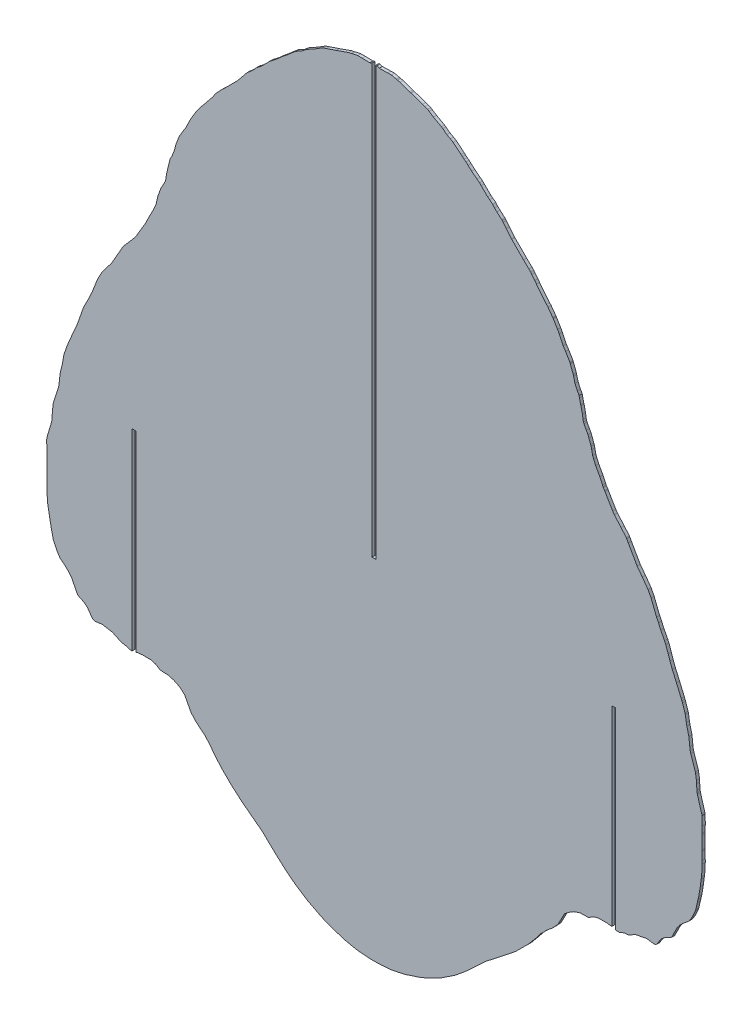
SolidWorks part; units mm, degrees
ref_plane "Спереди" through (0, 0, 0) normal (0, 0, 1) x (1, 0, 0)
ref_plane "Сверху" through (0, 0, 0) normal (0, 1, 0) x (1, 0, 0)
ref_plane "Справа" through (0, 0, 0) normal (1, 0, 0) x (0, 0, -1)
sketch "Model" plane through (0, 0, 0) normal (0, 0, 1) x (1, 0, 0)
  line L0 (-7497.9467, 2023.4558) -> (-7500.6426, 2017.1112)
  line L1 (-7500.6426, 2017.1112) -> (-7501.0305, 2016.1207)
  line L2 (-7501.0305, 2016.1207) -> (-7501.4279, 2015.1691)
  line L3 (-7501.4279, 2015.1691) -> (-7503.0784, 2010.3746)
  line L4 (-7503.0784, 2010.3746) -> (-7503.3023, 2009.66)
  line L5 (-7503.3023, 2009.66) -> (-7504.1535, 2004.848)
  line L6 (-7504.1535, 2004.848) -> (-7504.496, 2003.0145)
  line L7 (-7504.496, 2003.0145) -> (-7505.7197, 1998.1165)
  line L8 (-7505.7197, 1998.1165) -> (-7506.4076, 1992.1158)
  line L9 (-7506.4076, 1992.1158) -> (-7506.7012, 1990.1251)
  line L10 (-7506.7012, 1990.1251) -> (-7506.946, 1989.2308)
  line L11 (-7506.946, 1989.2308) -> (-7510.1433, 1979.3137)
  line L12 (-7510.1433, 1979.3137) -> (-7510.716, 1974.5936)
  line L13 (-7510.716, 1974.5936) -> (-7510.7209, 1974.5536)
  line L14 (-7510.7209, 1974.5536) -> (-7510.7259, 1974.5137)
  line L15 (-7510.7259, 1974.5137) -> (-7510.7487, 1974.0958)
  line L16 (-7510.7487, 1974.0958) -> (-7510.7715, 1973.6781)
  line L17 (-7510.7715, 1973.6781) -> (-7511.1722, 1968.5629)
  line L18 (-7511.1722, 1968.5629) -> (-7511.4632, 1967.2933)
  line L19 (-7511.4632, 1967.2933) -> (-7514.367, 1957.5712)
  line L20 (-7514.367, 1957.5712) -> (-7514.4008, 1956.9962)
  line L21 (-7514.4008, 1956.9962) -> (-7514.4101, 1956.5912)
  line L22 (-7514.4101, 1956.5912) -> (-7514.4193, 1956.1862)
  line L23 (-7514.4193, 1956.1862) -> (-7514.4247, 1955.3981)
  line L24 (-7514.4247, 1955.3981) -> (-7514.2628, 1947.1219)
  line L25 (-7514.2628, 1947.1219) -> (-7514.2212, 1937.3397)
  line L26 (-7514.2212, 1937.3397) -> (-7514.2091, 1936.9847)
  line L27 (-7514.2091, 1936.9847) -> (-7514.3719, 1932.8768)
  line L28 (-7514.3719, 1932.8768) -> (-7514.3864, 1930.5543)
  line L29 (-7514.3864, 1930.5543) -> (-7514.1103, 1925.2838)
  line L30 (-7514.1103, 1925.2838) -> (-7513.8456, 1921.2826)
  line L31 (-7513.8456, 1921.2826) -> (-7513.1127, 1917.1886)
  line L32 (-7513.1127, 1917.1886) -> (-7511.3726, 1907.7911)
  line L33 (-7511.3726, 1907.7911) -> (-7510.8214, 1905.5643)
  line L34 (-7510.8214, 1905.5643) -> (-7510.2805, 1902.9569)
  line L35 (-7510.2805, 1902.9569) -> (-7507.7917, 1897.6613)
  line L36 (-7507.7917, 1897.6613) -> (-7505.8454, 1894.5458)
  line L37 (-7505.8454, 1894.5458) -> (-7503.2841, 1892.5111)
  line L38 (-7503.2841, 1892.5111) -> (-7501.9998, 1891.3712)
  line L39 (-7501.9998, 1891.3712) -> (-7499.9927, 1889.4144)
  line L40 (-7499.9927, 1889.4144) -> (-7498.9104, 1887.8602)
  line L41 (-7498.9104, 1887.8602) -> (-7498.3658, 1887.2845)
  line L42 (-7498.3658, 1887.2845) -> (-7494.419, 1879.6002)
  line L43 (-7494.419, 1879.6002) -> (-7494.3736, 1879.5624)
  line L44 (-7494.3736, 1879.5624) -> (-7494.3282, 1879.5245)
  line L45 (-7494.3282, 1879.5245) -> (-7490.8269, 1877.798)
  line L46 (-7490.8269, 1877.798) -> (-7490.2704, 1877.4926)
  line L47 (-7490.2704, 1877.4926) -> (-7488.3005, 1875.9325)
  line L48 (-7488.3005, 1875.9325) -> (-7485.4491, 1871.9811)
  line L49 (-7485.4491, 1871.9811) -> (-7484.6983, 1870.9366)
  line L50 (-7484.6983, 1870.9366) -> (-7484.0835, 1870.7382)
  line L51 (-7484.0835, 1870.7382) -> (-7483.4687, 1870.5397)
  line L52 (-7483.4687, 1870.5397) -> (-7483.3924, 1870.4733)
  line L53 (-7483.3924, 1870.4733) -> (-7483.316, 1870.4069)
  line L54 (-7483.316, 1870.4069) -> (-7482.274, 1870.5902)
  line L55 (-7482.274, 1870.5902) -> (-7478.4124, 1871.0638)
  line L56 (-7478.4124, 1871.0638) -> (-7477.9965, 1870.9762)
  line L57 (-7477.9965, 1870.9762) -> (-7477.5807, 1870.8885)
  line L58 (-7477.5807, 1870.8885) -> (-7472.6305, 1870.0441)
  line L59 (-7472.6305, 1870.0441) -> (-7472.0241, 1869.8947)
  line L60 (-7472.0241, 1869.8947) -> (-7471.4176, 1869.745)
  line L61 (-7471.4176, 1869.745) -> (-7471.1804, 1869.6014)
  line L62 (-7471.1804, 1869.6014) -> (-7470.9433, 1869.4576)
  line L63 (-7470.9433, 1869.4576) -> (-7470.283, 1869.1666)
  line L64 (-7470.283, 1869.1666) -> (-7469.6228, 1868.8756)
  line L65 (-7469.6228, 1868.8756) -> (-7466.2521, 1867.1725)
  line L66 (-7466.2521, 1867.1725) -> (-7464.3822, 1866.9462)
  line L67 (-7464.3822, 1866.9462) -> (-7463.2148, 1866.6659)
  line L68 (-7463.2148, 1866.6659) -> (-7462.0473, 1866.3856)
  line L69 (-7462.0473, 1866.3856) -> (-7461.513, 1866.0946)
  line L70 (-7461.513, 1866.0946) -> (-7460.9787, 1865.8033)
  line L71 (-7460.9787, 1865.8033) -> (-7460.7605, 1865.7833)
  line L72 (-7460.7605, 1865.7833) -> (-7460.5423, 1865.7633)
  line L73 (-7460.5423, 1865.7633) -> (-7459.7682, 1865.7955)
  line L74 (-7459.7682, 1865.7955) -> (-7459.2442, 1865.8174)
  line L75 (-7459.2442, 1865.8174) -> (-7459.2442, 1990.1417)
  line L76 (-7459.2442, 1990.1417) -> (-7458.9942, 1990.1417)
  line L77 (-7458.9942, 1990.1417) -> (-7456.9942, 1990.1417)
  line L78 (-7456.9942, 1990.1417) -> (-7456.7442, 1990.1417)
  line L79 (-7456.7442, 1990.1417) -> (-7456.7442, 1866.3402)
  line L80 (-7456.7442, 1866.3402) -> (-7456.4584, 1866.4423)
  line L81 (-7456.4584, 1866.4423) -> (-7455.9226, 1866.6337)
  line L82 (-7455.9226, 1866.6337) -> (-7452.735, 1866.9823)
  line L83 (-7452.735, 1866.9823) -> (-7447.3945, 1866.9166)
  line L84 (-7447.3945, 1866.9166) -> (-7446.8888, 1866.9794)
  line L85 (-7446.8888, 1866.9794) -> (-7444.6596, 1866.2577)
  line L86 (-7444.6596, 1866.2577) -> (-7444.0137, 1866.0345)
  line L87 (-7444.0137, 1866.0345) -> (-7441.2335, 1864.2804)
  line L88 (-7441.2335, 1864.2804) -> (-7441.1634, 1864.2372)
  line L89 (-7441.1634, 1864.2372) -> (-7441.0933, 1864.194)
  line L90 (-7441.0933, 1864.194) -> (-7441.0633, 1864.191)
  line L91 (-7441.0633, 1864.191) -> (-7441.0334, 1864.1881)
  line L92 (-7441.0334, 1864.1881) -> (-7440.9624, 1864.1739)
  line L93 (-7440.9624, 1864.1739) -> (-7440.8914, 1864.1595)
  line L94 (-7440.8914, 1864.1595) -> (-7440.7779, 1864.1625)
  line L95 (-7440.7779, 1864.1625) -> (-7440.6644, 1864.1652)
  line L96 (-7440.6644, 1864.1652) -> (-7435.7736, 1863.9169)
  line L97 (-7435.7736, 1863.9169) -> (-7435.3781, 1863.9164)
  line L98 (-7435.3781, 1863.9164) -> (-7434.6278, 1863.6351)
  line L99 (-7434.6278, 1863.6351) -> (-7433.8775, 1863.3536)
  line L100 (-7433.8775, 1863.3536) -> (-7433.4218, 1863.2167)
  line L101 (-7433.4218, 1863.2167) -> (-7432.6613, 1863.059)
  line L102 (-7432.6613, 1863.059) -> (-7431.854, 1862.7081)
  line L103 (-7431.854, 1862.7081) -> (-7428.3172, 1860.9379)
  line L104 (-7428.3172, 1860.9379) -> (-7425.2409, 1858.1959)
  line L105 (-7425.2409, 1858.1959) -> (-7425.2293, 1858.1852)
  line L106 (-7425.2293, 1858.1852) -> (-7425.2177, 1858.1747)
  line L107 (-7425.2177, 1858.1747) -> (-7424.9908, 1857.7369)
  line L108 (-7424.9908, 1857.7369) -> (-7421.3787, 1850.8043)
  line L109 (-7421.3787, 1850.8043) -> (-7421.003, 1850.2777)
  line L110 (-7421.003, 1850.2777) -> (-7418.5829, 1847.433)
  line L111 (-7418.5829, 1847.433) -> (-7416.2365, 1845.399)
  line L112 (-7416.2365, 1845.399) -> (-7412.2569, 1842.1661)
  line L113 (-7412.2569, 1842.1661) -> (-7410.5129, 1840.1593)
  line L114 (-7410.5129, 1840.1593) -> (-7409.7671, 1839.4247)
  line L115 (-7409.7671, 1839.4247) -> (-7406.8879, 1835.6644)
  line L116 (-7406.8879, 1835.6644) -> (-7402.7645, 1830.6551)
  line L117 (-7402.7645, 1830.6551) -> (-7402.3004, 1830.1178)
  line L118 (-7402.3004, 1830.1178) -> (-7401.8362, 1829.5804)
  line L119 (-7401.8362, 1829.5804) -> (-7397.1856, 1824.89)
  line L120 (-7397.1856, 1824.89) -> (-7394.3311, 1822.0721)
  line L121 (-7394.3311, 1822.0721) -> (-7391.2584, 1819.538)
  line L122 (-7391.2584, 1819.538) -> (-7390.4303, 1818.7936)
  line L123 (-7390.4303, 1818.7936) -> (-7389.1507, 1817.6268)
  line L124 (-7389.1507, 1817.6268) -> (-7386.6953, 1815.7213)
  line L125 (-7386.6953, 1815.7213) -> (-7374.9699, 1806.7738)
  line L126 (-7374.9699, 1806.7738) -> (-7370.1001, 1802.0641)
  line L127 (-7370.1001, 1802.0641) -> (-7365.4616, 1797.7201)
  line L128 (-7365.4616, 1797.7201) -> (-7360.5326, 1793.3229)
  line L129 (-7360.5326, 1793.3229) -> (-7355.0083, 1788.9054)
  line L130 (-7355.0083, 1788.9054) -> (-7353.362, 1787.6927)
  line L131 (-7353.362, 1787.6927) -> (-7350.607, 1785.8756)
  line L132 (-7350.607, 1785.8756) -> (-7345.9025, 1782.8116)
  line L133 (-7345.9025, 1782.8116) -> (-7342.8212, 1781.2672)
  line L134 (-7342.8212, 1781.2672) -> (-7338.9552, 1779.2279)
  line L135 (-7338.9552, 1779.2279) -> (-7335.6744, 1777.6757)
  line L136 (-7335.6744, 1777.6757) -> (-7332.1744, 1776.2101)
  line L137 (-7332.1744, 1776.2101) -> (-7328.8162, 1774.9982)
  line L138 (-7328.8162, 1774.9982) -> (-7324.9663, 1773.8363)
  line L139 (-7324.9663, 1773.8363) -> (-7322.8491, 1773.1232)
  line L140 (-7322.8491, 1773.1232) -> (-7322.1192, 1772.9066)
  line L141 (-7322.1192, 1772.9066) -> (-7317.4443, 1771.8556)
  line L142 (-7317.4443, 1771.8556) -> (-7317.3058, 1771.8246)
  line L143 (-7317.3058, 1771.8246) -> (-7316.9245, 1771.7833)
  line L144 (-7316.9245, 1771.7833) -> (-7313.7443, 1771.1263)
  line L145 (-7313.7443, 1771.1263) -> (-7307.0124, 1770.5392)
  line L146 (-7307.0124, 1770.5392) -> (-7302.6145, 1770.422)
  line L147 (-7302.6145, 1770.422) -> (-7297.9105, 1770.5692)
  line L148 (-7297.9105, 1770.5692) -> (-7291.3652, 1771.1542)
  line L149 (-7291.3652, 1771.1542) -> (-7288.5675, 1771.7479)
  line L150 (-7288.5675, 1771.7479) -> (-7288.2836, 1771.7816)
  line L151 (-7288.2836, 1771.7816) -> (-7287.9997, 1771.8151)
  line L152 (-7287.9997, 1771.8151) -> (-7287.7908, 1771.8619)
  line L153 (-7287.7908, 1771.8619) -> (-7287.5819, 1771.9088)
  line L154 (-7287.5819, 1771.9088) -> (-7282.5796, 1773.0704)
  line L155 (-7282.5796, 1773.0704) -> (-7281.8471, 1773.2906)
  line L156 (-7281.8471, 1773.2906) -> (-7279.5327, 1774.0966)
  line L157 (-7279.5327, 1774.0966) -> (-7275.6944, 1775.3065)
  line L158 (-7275.6944, 1775.3065) -> (-7272.4718, 1776.4506)
  line L159 (-7272.4718, 1776.4506) -> (-7269.6285, 1777.663)
  line L160 (-7269.6285, 1777.663) -> (-7266.5203, 1779.1383)
  line L161 (-7266.5203, 1779.1383) -> (-7262.4004, 1781.285)
  line L162 (-7262.4004, 1781.285) -> (-7259.2552, 1782.8859)
  line L163 (-7259.2552, 1782.8859) -> (-7254.3601, 1786.1176)
  line L164 (-7254.3601, 1786.1176) -> (-7251.7627, 1787.8268)
  line L165 (-7251.7627, 1787.8268) -> (-7250.3816, 1788.8214)
  line L166 (-7250.3816, 1788.8214) -> (-7244.6867, 1793.4034)
  line L167 (-7244.6867, 1793.4034) -> (-7240.6341, 1797.0858)
  line L168 (-7240.6341, 1797.0858) -> (-7236.6093, 1800.7867)
  line L169 (-7236.6093, 1800.7867) -> (-7230.3919, 1806.5961)
  line L170 (-7230.3919, 1806.5961) -> (-7229.1579, 1807.5507)
  line L171 (-7229.1579, 1807.5507) -> (-7212.9107, 1820.2904)
  line L172 (-7212.9107, 1820.2904) -> (-7211.1697, 1821.8143)
  line L173 (-7211.1697, 1821.8143) -> (-7204.0301, 1828.8754)
  line L174 (-7204.0301, 1828.8754) -> (-7203.6757, 1829.2299)
  line L175 (-7203.6757, 1829.2299) -> (-7202.7729, 1830.2147)
  line L176 (-7202.7729, 1830.2147) -> (-7198.2298, 1835.6429)
  line L177 (-7198.2298, 1835.6429) -> (-7195.1637, 1839.6456)
  line L178 (-7195.1637, 1839.6456) -> (-7192.9741, 1841.7357)
  line L179 (-7192.9741, 1841.7357) -> (-7191.7177, 1843.1935)
  line L180 (-7191.7177, 1843.1935) -> (-7188.1277, 1846.1334)
  line L181 (-7188.1277, 1846.1334) -> (-7187.2744, 1846.8663)
  line L182 (-7187.2744, 1846.8663) -> (-7184.2405, 1850.1603)
  line L183 (-7184.2405, 1850.1603) -> (-7183.9644, 1850.577)
  line L184 (-7183.9644, 1850.577) -> (-7179.7517, 1858.5421)
  line L185 (-7179.7517, 1858.5421) -> (-7179.7426, 1858.5563)
  line L186 (-7179.7426, 1858.5563) -> (-7179.7238, 1858.5734)
  line L187 (-7179.7238, 1858.5734) -> (-7179.705, 1858.5905)
  line L188 (-7179.705, 1858.5905) -> (-7175.8548, 1861.4667)
  line L189 (-7175.8548, 1861.4667) -> (-7174.1703, 1862.4039)
  line L190 (-7174.1703, 1862.4039) -> (-7172.105, 1863.2098)
  line L191 (-7172.105, 1863.2098) -> (-7169.6242, 1864.0177)
  line L192 (-7169.6242, 1864.0177) -> (-7168.7214, 1863.9991)
  line L193 (-7168.7214, 1863.9991) -> (-7164.3725, 1864.1088)
  line L194 (-7164.3725, 1864.1088) -> (-7164.2621, 1864.1268)
  line L195 (-7164.2621, 1864.1268) -> (-7164.1516, 1864.1447)
  line L196 (-7164.1516, 1864.1447) -> (-7161.5025, 1865.9171)
  line L197 (-7161.5025, 1865.9171) -> (-7160.7705, 1866.2316)
  line L198 (-7160.7705, 1866.2316) -> (-7157.9358, 1867.0131)
  line L199 (-7157.9358, 1867.0131) -> (-7157.6336, 1866.9811)
  line L200 (-7157.6336, 1866.9811) -> (-7152.4018, 1866.9789)
  line L201 (-7152.4018, 1866.9789) -> (-7149.2442, 1866.6466)
  line L202 (-7149.2442, 1866.6466) -> (-7149.2442, 1990.1417)
  line L203 (-7149.2442, 1990.1417) -> (-7148.9942, 1990.1417)
  line L204 (-7148.9942, 1990.1417) -> (-7146.9942, 1990.1417)
  line L205 (-7146.9942, 1990.1417) -> (-7146.7442, 1990.1417)
  line L206 (-7146.7442, 1990.1417) -> (-7146.7442, 1865.8138)
  line L207 (-7146.7442, 1865.8138) -> (-7146.7356, 1865.8109)
  line L208 (-7146.7356, 1865.8109) -> (-7144.831, 1865.7367)
  line L209 (-7144.831, 1865.7367) -> (-7144.4452, 1865.7391)
  line L210 (-7144.4452, 1865.7391) -> (-7143.717, 1866.1136)
  line L211 (-7143.717, 1866.1136) -> (-7142.9889, 1866.4879)
  line L212 (-7142.9889, 1866.4879) -> (-7141.9963, 1866.744)
  line L213 (-7141.9963, 1866.744) -> (-7141.0037, 1867.0001)
  line L214 (-7141.0037, 1867.0001) -> (-7138.4158, 1867.2423)
  line L215 (-7138.4158, 1867.2423) -> (-7134.6339, 1869.3578)
  line L216 (-7134.6339, 1869.3578) -> (-7134.2803, 1869.5289)
  line L217 (-7134.2803, 1869.5289) -> (-7134.0622, 1869.663)
  line L218 (-7134.0622, 1869.663) -> (-7133.6119, 1869.7863)
  line L219 (-7133.6119, 1869.7863) -> (-7128.0332, 1870.8636)
  line L220 (-7128.0332, 1870.8636) -> (-7126.8495, 1871.1188)
  line L221 (-7126.8495, 1871.1188) -> (-7125.7958, 1870.9896)
  line L222 (-7125.7958, 1870.9896) -> (-7124.7422, 1870.8602)
  line L223 (-7124.7422, 1870.8602) -> (-7123.4416, 1870.6737)
  line L224 (-7123.4416, 1870.6737) -> (-7122.8226, 1870.545)
  line L225 (-7122.8226, 1870.545) -> (-7122.2036, 1870.4161)
  line L226 (-7122.2036, 1870.4161) -> (-7121.9822, 1870.6022)
  line L227 (-7121.9822, 1870.6022) -> (-7121.3062, 1870.6793)
  line L228 (-7121.3062, 1870.6793) -> (-7120.6302, 1870.7565)
  line L229 (-7120.6302, 1870.7565) -> (-7119.7912, 1871.9027)
  line L230 (-7119.7912, 1871.9027) -> (-7117.2733, 1875.6085)
  line L231 (-7117.2733, 1875.6085) -> (-7117.2016, 1875.6847)
  line L232 (-7117.2016, 1875.6847) -> (-7117.1299, 1875.7609)
  line L233 (-7117.1299, 1875.7609) -> (-7117.0839, 1875.8419)
  line L234 (-7117.0839, 1875.8419) -> (-7117.0379, 1875.923)
  line L235 (-7117.0379, 1875.923) -> (-7116.7871, 1876.1263)
  line L236 (-7116.7871, 1876.1263) -> (-7114.8937, 1877.566)
  line L237 (-7114.8937, 1877.566) -> (-7114.3626, 1877.8517)
  line L238 (-7114.3626, 1877.8517) -> (-7113.8316, 1878.1373)
  line L239 (-7113.8316, 1878.1373) -> (-7110.8553, 1879.6276)
  line L240 (-7110.8553, 1879.6276) -> (-7110.6672, 1879.7914)
  line L241 (-7110.6672, 1879.7914) -> (-7106.8875, 1887.2306)
  line L242 (-7106.8875, 1887.2306) -> (-7106.6991, 1887.4247)
  line L243 (-7106.6991, 1887.4247) -> (-7106.5106, 1887.6188)
  line L244 (-7106.5106, 1887.6188) -> (-7105.1686, 1889.4862)
  line L245 (-7105.1686, 1889.4862) -> (-7103.6316, 1890.9938)
  line L246 (-7103.6316, 1890.9938) -> (-7101.8646, 1892.5565)
  line L247 (-7101.8646, 1892.5565) -> (-7100.081, 1893.912)
  line L248 (-7100.081, 1893.912) -> (-7099.0223, 1894.9501)
  line L249 (-7099.0223, 1894.9501) -> (-7097.3332, 1897.7479)
  line L250 (-7097.3332, 1897.7479) -> (-7095.1587, 1902.5216)
  line L251 (-7095.1587, 1902.5216) -> (-7095.0015, 1903.234)
  line L252 (-7095.0015, 1903.234) -> (-7093.9376, 1907.7653)
  line L253 (-7093.9376, 1907.7653) -> (-7093.5925, 1909.3988)
  line L254 (-7093.5925, 1909.3988) -> (-7093.085, 1911.3571)
  line L255 (-7093.085, 1911.3571) -> (-7092.0302, 1917.6908)
  line L256 (-7092.0302, 1917.6908) -> (-7091.5307, 1921.8605)
  line L257 (-7091.5307, 1921.8605) -> (-7091.2381, 1923.3607)
  line L258 (-7091.2381, 1923.3607) -> (-7090.8495, 1930.5809)
  line L259 (-7090.8495, 1930.5809) -> (-7090.8575, 1932.7682)
  line L260 (-7090.8575, 1932.7682) -> (-7091.0507, 1937.7003)
  line L261 (-7091.0507, 1937.7003) -> (-7090.9997, 1938.5343)
  line L262 (-7090.9997, 1938.5343) -> (-7090.9768, 1946.8641)
  line L263 (-7090.9768, 1946.8641) -> (-7091.0024, 1947.8505)
  line L264 (-7091.0024, 1947.8505) -> (-7090.8322, 1952.015)
  line L265 (-7090.8322, 1952.015) -> (-7090.9019, 1957.7938)
  line L266 (-7090.9019, 1957.7938) -> (-7090.9148, 1957.8397)
  line L267 (-7090.9148, 1957.8397) -> (-7090.9278, 1957.8854)
  line L268 (-7090.9278, 1957.8854) -> (-7091.1708, 1958.7394)
  line L269 (-7091.1708, 1958.7394) -> (-7093.919, 1968.1774)
  line L270 (-7093.919, 1968.1774) -> (-7094.0616, 1968.823)
  line L271 (-7094.0616, 1968.823) -> (-7094.2191, 1970.3501)
  line L272 (-7094.2191, 1970.3501) -> (-7094.5031, 1973.8024)
  line L273 (-7094.5031, 1973.8024) -> (-7094.546, 1975.8514)
  line L274 (-7094.546, 1975.8514) -> (-7095.0951, 1978.9498)
  line L275 (-7095.0951, 1978.9498) -> (-7095.2595, 1980.0636)
  line L276 (-7095.2595, 1980.0636) -> (-7098.182, 1988.8456)
  line L277 (-7098.182, 1988.8456) -> (-7098.5345, 1990.1333)
  line L278 (-7098.5345, 1990.1333) -> (-7098.8687, 1992.4855)
  line L279 (-7098.8687, 1992.4855) -> (-7099.4575, 1997.8693)
  line L280 (-7099.4575, 1997.8693) -> (-7100.7433, 2003.0062)
  line L281 (-7100.7433, 2003.0062) -> (-7101.0871, 2004.8221)
  line L282 (-7101.0871, 2004.8221) -> (-7101.7682, 2009.028)
  line L283 (-7101.7682, 2009.028) -> (-7102.0108, 2009.7946)
  line L284 (-7102.0108, 2009.7946) -> (-7103.5566, 2014.5498)
  line L285 (-7103.5566, 2014.5498) -> (-7103.9518, 2015.4976)
  line L286 (-7103.9518, 2015.4976) -> (-7104.3956, 2016.629)
  line L287 (-7104.3956, 2016.629) -> (-7107.4665, 2023.8837)
  line L288 (-7107.4665, 2023.8837) -> (-7110.19, 2030.0762)
  line L289 (-7110.19, 2030.0762) -> (-7111.6432, 2033.9207)
  line L290 (-7111.6432, 2033.9207) -> (-7112.7766, 2037.2738)
  line L291 (-7112.7766, 2037.2738) -> (-7114.3432, 2041.8114)
  line L292 (-7114.3432, 2041.8114) -> (-7115.1853, 2043.6505)
  line L293 (-7115.1853, 2043.6505) -> (-7117.5882, 2048.2667)
  line L294 (-7117.5882, 2048.2667) -> (-7119.0656, 2051.599)
  line L295 (-7119.0656, 2051.599) -> (-7120.3442, 2054.1881)
  line L296 (-7120.3442, 2054.1881) -> (-7123.8596, 2063.0946)
  line L297 (-7123.8596, 2063.0946) -> (-7123.8655, 2063.1067)
  line L298 (-7123.8655, 2063.1067) -> (-7123.8686, 2063.1122)
  line L299 (-7123.8686, 2063.1122) -> (-7123.8716, 2063.1178)
  line L300 (-7123.8716, 2063.1178) -> (-7125.8609, 2066.9584)
  line L301 (-7125.8609, 2066.9584) -> (-7129.537, 2072.0748)
  line L302 (-7129.537, 2072.0748) -> (-7132.8078, 2076.3871)
  line L303 (-7132.8078, 2076.3871) -> (-7138.6147, 2086.5865)
  line L304 (-7138.6147, 2086.5865) -> (-7139.5852, 2088.3856)
  line L305 (-7139.5852, 2088.3856) -> (-7139.8825, 2088.9581)
  line L306 (-7139.8825, 2088.9581) -> (-7143.2775, 2092.8542)
  line L307 (-7143.2775, 2092.8542) -> (-7147.5755, 2097.8612)
  line L308 (-7147.5755, 2097.8612) -> (-7148.6157, 2099.3238)
  line L309 (-7148.6157, 2099.3238) -> (-7153.6266, 2107.7745)
  line L310 (-7153.6266, 2107.7745) -> (-7153.87, 2108.3241)
  line L311 (-7153.87, 2108.3241) -> (-7154.6501, 2109.4105)
  line L312 (-7154.6501, 2109.4105) -> (-7154.8948, 2109.8671)
  line L313 (-7154.8948, 2109.8671) -> (-7155.2402, 2110.6775)
  line L314 (-7155.2402, 2110.6775) -> (-7156.9788, 2114.4181)
  line L315 (-7156.9788, 2114.4181) -> (-7159.6612, 2119.2949)
  line L316 (-7159.6612, 2119.2949) -> (-7160.9616, 2122.3004)
  line L317 (-7160.9616, 2122.3004) -> (-7161.5578, 2123.849)
  line L318 (-7161.5578, 2123.849) -> (-7162.2329, 2127.0226)
  line L319 (-7162.2329, 2127.0226) -> (-7162.5899, 2128.6849)
  line L320 (-7162.5899, 2128.6849) -> (-7162.8861, 2129.3463)
  line L321 (-7162.8861, 2129.3463) -> (-7164.0241, 2132.5216)
  line L322 (-7164.0241, 2132.5216) -> (-7164.6521, 2134.3124)
  line L323 (-7164.6521, 2134.3124) -> (-7165.7418, 2136.1444)
  line L324 (-7165.7418, 2136.1444) -> (-7167.2061, 2138.8673)
  line L325 (-7167.2061, 2138.8673) -> (-7167.5656, 2139.6754)
  line L326 (-7167.5656, 2139.6754) -> (-7167.8196, 2141.0409)
  line L327 (-7167.8196, 2141.0409) -> (-7168.2509, 2143.9373)
  line L328 (-7168.2509, 2143.9373) -> (-7169.1793, 2148.0297)
  line L329 (-7169.1793, 2148.0297) -> (-7169.3764, 2148.5503)
  line L330 (-7169.3764, 2148.5503) -> (-7170.1062, 2151.9581)
  line L331 (-7170.1062, 2151.9581) -> (-7170.371, 2153.1674)
  line L332 (-7170.371, 2153.1674) -> (-7171.4528, 2155.1886)
  line L333 (-7171.4528, 2155.1886) -> (-7173.0456, 2158.6534)
  line L334 (-7173.0456, 2158.6534) -> (-7173.9492, 2162.2008)
  line L335 (-7173.9492, 2162.2008) -> (-7174.1538, 2163.0812)
  line L336 (-7174.1538, 2163.0812) -> (-7176.0473, 2168.0165)
  line L337 (-7176.0473, 2168.0165) -> (-7176.181, 2168.5404)
  line L338 (-7176.181, 2168.5404) -> (-7176.3353, 2168.8509)
  line L339 (-7176.3353, 2168.8509) -> (-7179.0749, 2173.4442)
  line L340 (-7179.0749, 2173.4442) -> (-7180.6272, 2175.8419)
  line L341 (-7180.6272, 2175.8419) -> (-7183.2343, 2181.2609)
  line L342 (-7183.2343, 2181.2609) -> (-7184.3011, 2183.3029)
  line L343 (-7184.3011, 2183.3029) -> (-7187.0645, 2187.8041)
  line L344 (-7187.0645, 2187.8041) -> (-7187.2553, 2188.1414)
  line L345 (-7187.2553, 2188.1414) -> (-7187.4844, 2188.478)
  line L346 (-7187.4844, 2188.478) -> (-7190.5482, 2192.7003)
  line L347 (-7190.5482, 2192.7003) -> (-7191.3981, 2193.6298)
  line L348 (-7191.3981, 2193.6298) -> (-7197.8909, 2201.6671)
  line L349 (-7197.8909, 2201.6671) -> (-7199.0249, 2203.3331)
  line L350 (-7199.0249, 2203.3331) -> (-7200.9336, 2205.6151)
  line L351 (-7200.9336, 2205.6151) -> (-7201.7343, 2206.7245)
  line L352 (-7201.7343, 2206.7245) -> (-7202.8186, 2207.8118)
  line L353 (-7202.8186, 2207.8118) -> (-7206.2899, 2211.1805)
  line L354 (-7206.2899, 2211.1805) -> (-7213.8849, 2218.8096)
  line L355 (-7213.8849, 2218.8096) -> (-7213.9452, 2218.8719)
  line L356 (-7213.9452, 2218.8719) -> (-7214.0055, 2218.9344)
  line L357 (-7214.0055, 2218.9344) -> (-7214.0205, 2218.9495)
  line L358 (-7214.0205, 2218.9495) -> (-7214.0355, 2218.9645)
  line L359 (-7214.0355, 2218.9645) -> (-7217.4817, 2223.1295)
  line L360 (-7217.4817, 2223.1295) -> (-7219.4355, 2225.6378)
  line L361 (-7219.4355, 2225.6378) -> (-7219.9285, 2226.2718)
  line L362 (-7219.9285, 2226.2718) -> (-7220.0363, 2226.3722)
  line L363 (-7220.0363, 2226.3722) -> (-7220.1442, 2226.4727)
  line L364 (-7220.1442, 2226.4727) -> (-7220.2775, 2226.5721)
  line L365 (-7220.2775, 2226.5721) -> (-7220.4107, 2226.6715)
  line L366 (-7220.4107, 2226.6715) -> (-7223.5182, 2229.3931)
  line L367 (-7223.5182, 2229.3931) -> (-7224.9534, 2230.7816)
  line L368 (-7224.9534, 2230.7816) -> (-7226.2369, 2232.3411)
  line L369 (-7226.2369, 2232.3411) -> (-7228.1849, 2233.8094)
  line L370 (-7228.1849, 2233.8094) -> (-7229.4607, 2234.8231)
  line L371 (-7229.4607, 2234.8231) -> (-7233.6817, 2238.9926)
  line L372 (-7233.6817, 2238.9926) -> (-7234.7641, 2240.1051)
  line L373 (-7234.7641, 2240.1051) -> (-7236.3494, 2241.3373)
  line L374 (-7236.3494, 2241.3373) -> (-7239.7798, 2244.014)
  line L375 (-7239.7798, 2244.014) -> (-7242.1937, 2246.1334)
  line L376 (-7242.1937, 2246.1334) -> (-7243.508, 2247.4015)
  line L377 (-7243.508, 2247.4015) -> (-7244.7711, 2248.3235)
  line L378 (-7244.7711, 2248.3235) -> (-7245.7512, 2249.1291)
  line L379 (-7245.7512, 2249.1291) -> (-7246.6643, 2249.9645)
  line L380 (-7246.6643, 2249.9645) -> (-7251.8338, 2254.2417)
  line L381 (-7251.8338, 2254.2417) -> (-7253.5044, 2255.2438)
  line L382 (-7253.5044, 2255.2438) -> (-7255.8533, 2256.4569)
  line L383 (-7255.8533, 2256.4569) -> (-7258.4648, 2258.5709)
  line L384 (-7258.4648, 2258.5709) -> (-7259.4134, 2259.149)
  line L385 (-7259.4134, 2259.149) -> (-7264.4873, 2261.9563)
  line L386 (-7264.4873, 2261.9563) -> (-7267.3197, 2263.7721)
  line L387 (-7267.3197, 2263.7721) -> (-7268.4064, 2264.4728)
  line L388 (-7268.4064, 2264.4728) -> (-7269.9691, 2265.0834)
  line L389 (-7269.9691, 2265.0834) -> (-7271.5104, 2265.5558)
  line L390 (-7271.5104, 2265.5558) -> (-7278.8352, 2268.1771)
  line L391 (-7278.8352, 2268.1771) -> (-7279.1921, 2268.2438)
  line L392 (-7279.1921, 2268.2438) -> (-7279.9044, 2268.4386)
  line L393 (-7279.9044, 2268.4386) -> (-7286.0682, 2270.6998)
  line L394 (-7286.0682, 2270.6998) -> (-7287.6266, 2270.9534)
  line L395 (-7287.6266, 2270.9534) -> (-7288.0985, 2271.0941)
  line L396 (-7288.0985, 2271.0941) -> (-7288.5703, 2271.235)
  line L397 (-7288.5703, 2271.235) -> (-7291.7647, 2271.9674)
  line L398 (-7291.7647, 2271.9674) -> (-7294.1066, 2271.9252)
  line L399 (-7294.1066, 2271.9252) -> (-7299.5401, 2271.7858)
  line L400 (-7299.5401, 2271.7858) -> (-7301.0447, 2272.3602)
  line L401 (-7301.0447, 2272.3602) -> (-7301.7442, 2272.3682)
  line L402 (-7301.7442, 2272.3682) -> (-7301.7442, 2056.3378)
  line L403 (-7301.7442, 2056.3378) -> (-7301.9942, 2056.3378)
  line L404 (-7301.9942, 2056.3378) -> (-7303.9942, 2056.3378)
  line L405 (-7303.9942, 2056.3378) -> (-7304.2442, 2056.3378)
  line L406 (-7304.2442, 2056.3378) -> (-7304.2442, 2272.2856)
  line L407 (-7304.2442, 2272.2856) -> (-7305.6078, 2271.8226)
  line L408 (-7305.6078, 2271.8226) -> (-7310.4582, 2271.9342)
  line L409 (-7310.4582, 2271.9342) -> (-7313.398, 2271.9579)
  line L410 (-7313.398, 2271.9579) -> (-7317.0286, 2271.1815)
  line L411 (-7317.0286, 2271.1815) -> (-7317.8558, 2270.9506)
  line L412 (-7317.8558, 2270.9506) -> (-7319.1767, 2270.7462)
  line L413 (-7319.1767, 2270.7462) -> (-7327.2928, 2267.8932)
  line L414 (-7327.2928, 2267.8932) -> (-7327.388, 2267.8656)
  line L415 (-7327.388, 2267.8656) -> (-7327.4356, 2267.8573)
  line L416 (-7327.4356, 2267.8573) -> (-7333.7463, 2265.7059)
  line L417 (-7333.7463, 2265.7059) -> (-7335.092, 2265.3026)
  line L418 (-7335.092, 2265.3026) -> (-7336.3783, 2264.808)
  line L419 (-7336.3783, 2264.808) -> (-7337.276, 2264.2235)
  line L420 (-7337.276, 2264.2235) -> (-7340.7956, 2261.9899)
  line L421 (-7340.7956, 2261.9899) -> (-7346.5277, 2258.8253)
  line L422 (-7346.5277, 2258.8253) -> (-7346.6629, 2258.7455)
  line L423 (-7346.6629, 2258.7455) -> (-7346.7981, 2258.6654)
  line L424 (-7346.7981, 2258.6654) -> (-7349.6802, 2256.3287)
  line L425 (-7349.6802, 2256.3287) -> (-7352.3872, 2254.8956)
  line L426 (-7352.3872, 2254.8956) -> (-7353.7481, 2254.0751)
  line L427 (-7353.7481, 2254.0751) -> (-7358.4114, 2250.1207)
  line L428 (-7358.4114, 2250.1207) -> (-7359.0913, 2249.5028)
  line L429 (-7359.0913, 2249.5028) -> (-7361.3953, 2247.6141)
  line L430 (-7361.3953, 2247.6141) -> (-7362.4685, 2246.7831)
  line L431 (-7362.4685, 2246.7831) -> (-7362.675, 2246.5787)
  line L432 (-7362.675, 2246.5787) -> (-7362.8816, 2246.3746)
  line L433 (-7362.8816, 2246.3746) -> (-7365.7547, 2243.8314)
  line L434 (-7365.7547, 2243.8314) -> (-7369.296, 2241.0533)
  line L435 (-7369.296, 2241.0533) -> (-7370.4696, 2240.1405)
  line L436 (-7370.4696, 2240.1405) -> (-7371.6427, 2238.9027)
  line L437 (-7371.6427, 2238.9027) -> (-7375.7663, 2234.7997)
  line L438 (-7375.7663, 2234.7997) -> (-7377.777, 2233.244)
  line L439 (-7377.777, 2233.244) -> (-7378.9398, 2232.3817)
  line L440 (-7378.9398, 2232.3817) -> (-7380.2642, 2230.7823)
  line L441 (-7380.2642, 2230.7823) -> (-7381.6322, 2229.4667)
  line L442 (-7381.6322, 2229.4667) -> (-7384.8557, 2226.6276)
  line L443 (-7384.8557, 2226.6276) -> (-7385.3482, 2226.1788)
  line L444 (-7385.3482, 2226.1788) -> (-7385.4061, 2226.0863)
  line L445 (-7385.4061, 2226.0863) -> (-7385.4639, 2225.994)
  line L446 (-7385.4639, 2225.994) -> (-7387.4986, 2223.463)
  line L447 (-7387.4986, 2223.463) -> (-7390.7095, 2219.5338)
  line L448 (-7390.7095, 2219.5338) -> (-7391.0565, 2219.1202)
  line L449 (-7391.0565, 2219.1202) -> (-7391.147, 2219.0189)
  line L450 (-7391.147, 2219.0189) -> (-7398.7832, 2211.3383)
  line L451 (-7398.7832, 2211.3383) -> (-7401.0719, 2209.1764)
  line L452 (-7401.0719, 2209.1764) -> (-7402.8203, 2207.4039)
  line L453 (-7402.8203, 2207.4039) -> (-7404.8589, 2205.1722)
  line L454 (-7404.8589, 2205.1722) -> (-7406.2265, 2203.2758)
  line L455 (-7406.2265, 2203.2758) -> (-7407.4618, 2201.496)
  line L456 (-7407.4618, 2201.496) -> (-7413.7755, 2193.6954)
  line L457 (-7413.7755, 2193.6954) -> (-7414.6486, 2192.745)
  line L458 (-7414.6486, 2192.745) -> (-7417.7135, 2188.545)
  line L459 (-7417.7135, 2188.545) -> (-7417.8736, 2188.3116)
  line L460 (-7417.8736, 2188.3116) -> (-7417.9398, 2188.1954)
  line L461 (-7417.9398, 2188.1954) -> (-7418.0061, 2188.079)
  line L462 (-7418.0061, 2188.079) -> (-7420.9153, 2183.3192)
  line L463 (-7420.9153, 2183.3192) -> (-7422.1023, 2181.0507)
  line L464 (-7422.1023, 2181.0507) -> (-7424.5811, 2175.912)
  line L465 (-7424.5811, 2175.912) -> (-7426.1852, 2173.4357)
  line L466 (-7426.1852, 2173.4357) -> (-7429.0358, 2168.5438)
  line L467 (-7429.0358, 2168.5438) -> (-7429.0459, 2168.5233)
  line L468 (-7429.0459, 2168.5233) -> (-7429.0559, 2168.5029)
  line L469 (-7429.0559, 2168.5029) -> (-7429.0639, 2168.4706)
  line L470 (-7429.0639, 2168.4706) -> (-7429.0719, 2168.4384)
  line L471 (-7429.0719, 2168.4384) -> (-7431.0454, 2163.1393)
  line L472 (-7431.0454, 2163.1393) -> (-7431.2273, 2162.3529)
  line L473 (-7431.2273, 2162.3529) -> (-7432.2128, 2158.6588)
  line L474 (-7432.2128, 2158.6588) -> (-7433.6487, 2155.3986)
  line L475 (-7433.6487, 2155.3986) -> (-7434.6917, 2153.5048)
  line L476 (-7434.6917, 2153.5048) -> (-7435.0014, 2152.1296)
  line L477 (-7435.0014, 2152.1296) -> (-7435.888, 2148.4807)
  line L478 (-7435.888, 2148.4807) -> (-7435.9853, 2148.2229)
  line L479 (-7435.9853, 2148.2229) -> (-7436.9688, 2143.9235)
  line L480 (-7436.9688, 2143.9235) -> (-7437.4022, 2141.1313)
  line L481 (-7437.4022, 2141.1313) -> (-7437.711, 2139.6036)
  line L482 (-7437.711, 2139.6036) -> (-7438.094, 2138.7711)
  line L483 (-7438.094, 2138.7711) -> (-7439.5297, 2136.0758)
  line L484 (-7439.5297, 2136.0758) -> (-7440.5484, 2134.3339)
  line L485 (-7440.5484, 2134.3339) -> (-7441.1381, 2132.7269)
  line L486 (-7441.1381, 2132.7269) -> (-7442.3776, 2129.2902)
  line L487 (-7442.3776, 2129.2902) -> (-7442.584, 2128.8302)
  line L488 (-7442.584, 2128.8302) -> (-7443.0663, 2126.6647)
  line L489 (-7443.0663, 2126.6647) -> (-7443.766, 2123.5365)
  line L490 (-7443.766, 2123.5365) -> (-7444.3037, 2122.1935)
  line L491 (-7444.3037, 2122.1935) -> (-7445.481, 2119.4932)
  line L492 (-7445.481, 2119.4932) -> (-7447.9444, 2114.9664)
  line L493 (-7447.9444, 2114.9664) -> (-7449.8604, 2110.942)
  line L494 (-7449.8604, 2110.942) -> (-7450.3059, 2109.9047)
  line L495 (-7450.3059, 2109.9047) -> (-7450.5668, 2109.4122)
  line L496 (-7450.5668, 2109.4122) -> (-7451.5436, 2108.0321)
  line L497 (-7451.5436, 2108.0321) -> (-7451.8589, 2107.3368)
  line L498 (-7451.8589, 2107.3368) -> (-7456.5977, 2099.3512)
  line L499 (-7456.5977, 2099.3512) -> (-7457.636, 2097.8812)
  line L500 (-7457.636, 2097.8812) -> (-7461.8783, 2092.9463)
  line L501 (-7461.8783, 2092.9463) -> (-7465.1659, 2089.1885)
  line L502 (-7465.1659, 2089.1885) -> (-7465.5454, 2088.4836)
  line L503 (-7465.5454, 2088.4836) -> (-7466.8018, 2086.1772)
  line L504 (-7466.8018, 2086.1772) -> (-7472.4782, 2076.3041)
  line L505 (-7472.4782, 2076.3041) -> (-7475.7133, 2072.0431)
  line L506 (-7475.7133, 2072.0431) -> (-7479.3552, 2066.9757)
  line L507 (-7479.3552, 2066.9757) -> (-7480.6588, 2064.4467)
  line L508 (-7480.6588, 2064.4467) -> (-7481.1405, 2063.5699)
  line L509 (-7481.1405, 2063.5699) -> (-7481.818, 2062.1764)
  line L510 (-7481.818, 2062.1764) -> (-7484.9774, 2053.9297)
  line L511 (-7484.9774, 2053.9297) -> (-7486.2246, 2051.4377)
  line L512 (-7486.2246, 2051.4377) -> (-7487.6162, 2048.3102)
  line L513 (-7487.6162, 2048.3102) -> (-7490.0433, 2043.6558)
  line L514 (-7490.0433, 2043.6558) -> (-7490.8711, 2041.8434)
  line L515 (-7490.8711, 2041.8434) -> (-7492.6136, 2036.787)
  line L516 (-7492.6136, 2036.787) -> (-7493.6729, 2033.662)
  line L517 (-7493.6729, 2033.662) -> (-7494.9649, 2030.2404)
  line L518 (-7494.9649, 2030.2404) -> (-7497.9467, 2023.4558)
  line L519 (-7456.7442, 1990.1417) -> (-7149.2442, 1990.1417) construction
extrude "Бобышка-Вытянуть1" add sketch "Model" along normal blind 2
sketch "Эскиз3" plane through (0, 0, 0) normal (0, 0, -1) x (-1, 0, 0)
  line L0 (7301.7442, 2056.3378) -> (7301.7442, 1995.8378) construction
  line L2 (7304.2442, 2056.3378) -> (7301.7442, 2056.3378)
  line L3 (7304.2442, 2056.3378) -> (7304.2442, 1995.8378)
  line L4 (7304.2442, 1995.8378) -> (7301.7442, 1995.8378)
  line L5 (7301.7442, 2056.3378) -> (7301.7442, 1995.8378)
  dimension "D1" = 60.5
extrude "Вырез-Вытянуть1" cut sketch "Эскиз3" against normal blind 10
